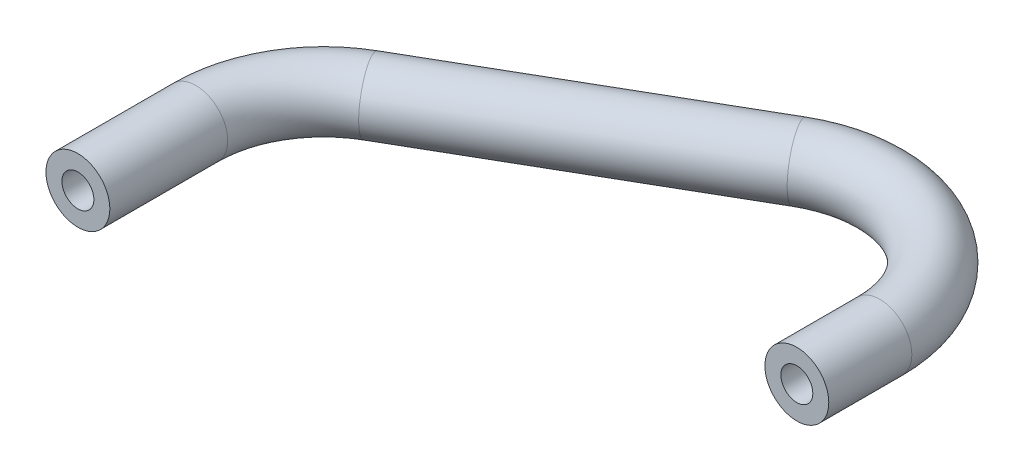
SolidWorks part; units mm, degrees
ref_plane "Front Plane" through (0, 0, 0) normal (0, 0, 1) x (1, 0, 0)
ref_plane "Top Plane" through (0, 0, 0) normal (0, 1, 0) x (1, 0, 0)
ref_plane "Right Plane" through (0, 0, 0) normal (1, 0, 0) x (0, 0, -1)
sketch "Sketch1" plane through (0, 0, 0) normal (0, 0, 1) x (1, 0, 0)
  circle A0 centre (0, 0) radius 3.175
  circle A1 centre (0, 0) radius 1.5875
  dimension "D1" = 6.35
  dimension "D2" = 3.175
sketch "Sketch2" plane through (0, 0, 0) normal (0, 1, 0) x (1, 0, 0)
  line L0 (0, 0) -> (0, 11.7177)
  line L2 (52.3946, 27.303) -> (52.3946, 19.05)
  line L3 (6.35, 22.7162) -> (33.3446, 38.3015)
  arc A0 (6.35, 22.7162) -> (0, 11.7177) centre (12.7, 11.7177) ccw
  arc A1 (52.3946, 27.303) -> (33.3446, 38.3015) centre (39.6946, 27.303) ccw
  point P4 (0, 19.05)
  dimension "D4" = 19.05
  dimension "D2" = 12.7
  dimension "D1" = 52.3946
  dimension "D3" = 19.05
  dimension "D5" = 120
sweep "Sweep1" add profiles "Sketch1" path "Sketch2"
